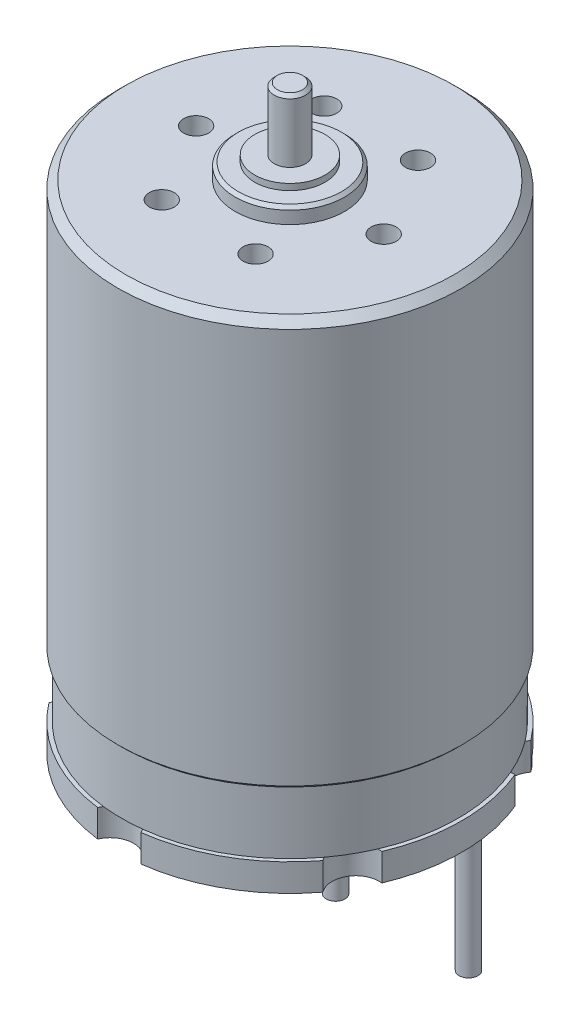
SolidWorks part; units mm, degrees
other "<ALD_M840029__P_Portescap_22NT_82_213P>-<Extrusion26>"
ref_plane "Face" through (0, 0, 0) normal (0, 0, 1) x (1, 0, 0)
ref_plane "Dessus" through (0, 0, 0) normal (0, 1, 0) x (1, 0, 0)
ref_plane "Droite" through (0, 0, 0) normal (1, 0, 0) x (0, 0, -1)
inserted part "ALD_M840029__P_Portescap_22NT_82_213P"
